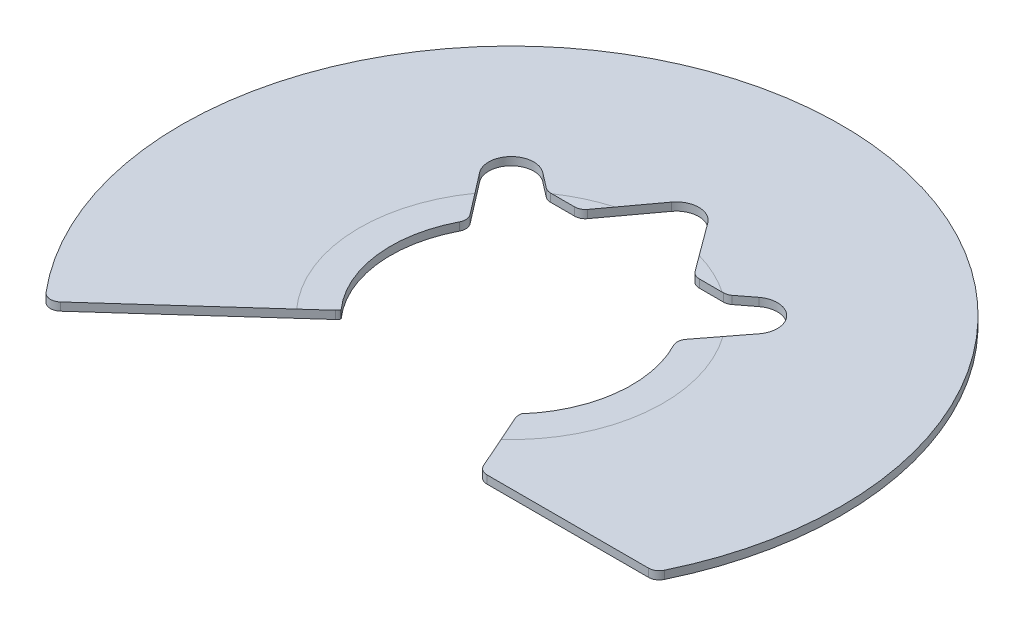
SolidWorks part; units mm, degrees
ref_plane "Front Plane" through (0, 0, 0) normal (0, 0, 1) x (1, 0, 0)
ref_plane "Top Plane" through (0, 0, 0) normal (0, 1, 0) x (1, 0, 0)
ref_plane "Right Plane" through (0, 0, 0) normal (1, 0, 0) x (0, 0, -1)
sketch "Sketch1" plane through (0, 0, 0) normal (0, 1, 0) x (1, 0, 0)
  line L0 (-72.6721, -65.4343) -> (-26.67, -24.0138)
  line L1 (-26.67, -24.0138) -> (-26.67, 12.8531)
  line L4 (0, 0) -> (0, 105.2902) construction
  line L8 (0, 0) -> (-72.6721, -65.4343) construction
  line L9 (35.2071, -44.45) -> (87.1039, -44.45)
  line L11 (-26.67, 37.2649) -> (-6.6675, 37.2649)
  line L15 (6.6675, 37.2649) -> (26.67, 37.2649)
  line L17 (6.6675, 48.895) -> (6.6675, 29.6862)
  line L18 (-6.6675, 29.6863) -> (-6.6675, 48.895)
  line L19 (6.6675, 48.895) -> (6.6675, 37.2649)
  line L20 (-6.6675, 37.2649) -> (-6.6675, 48.895)
  line L43 (-6.6675, 48.895) -> (-6.6675, 29.6863)
  line L44 (-10.3187, 26.035) -> (-10.7955, 26.035)
  line L45 (-13.0182, 26.7895) -> (-32.0265, 41.3751)
  line L46 (-41.3751, 32.0265) -> (-26.7895, 13.0182)
  line L47 (-26.035, 10.7955) -> (-26.035, -22.9553)
  line L48 (-26.3474, -24.4331) -> (-32.767, -38.937)
  line L49 (-21.6693, -46.0456) -> (-5.1121, -27.2712)
  line L50 (-2.3736, -26.035) -> (2.3736, -26.035)
  line L51 (5.1121, -27.2712) -> (21.6693, -46.0456)
  line L52 (32.767, -38.937) -> (26.3474, -24.4331)
  line L53 (26.035, -22.9553) -> (26.035, 10.7955)
  line L54 (26.7895, 13.0182) -> (41.3751, 32.0265)
  line L55 (32.0265, 41.3751) -> (13.0182, 26.7895)
  line L56 (10.7955, 26.035) -> (10.3188, 26.035)
  line L57 (6.6675, 29.6862) -> (6.6675, 48.895)
  line L60 (-26.67, 37.2649) -> (-32.0265, 41.3751)
  line L61 (-41.3751, 32.0265) -> (-26.7895, 13.0182)
  line L67 (35.2071, -44.45) -> (26.67, -25.1619)
  line L69 (26.7895, 13.0182) -> (41.3751, 32.0265)
  line L70 (32.0265, 41.3751) -> (26.67, 37.2649)
  line L642 (27.9044, 22.2464) -> (6.6675, 48.8846) construction
  line L646 (27.3086, 21.7714) -> (3.4756, 51.6659) construction
  line L943 (26.67, -25.1619) -> (26.67, 12.8531)
  arc A0 (87.1039, -44.45) -> (-72.6721, -65.4343) centre (0, 0) ccw
  arc A5 (30.6089, -34.0612) -> (26.67, -37.226) centre (0, 0) ccw construction
  circle A6 centre (0, 0) radius 45 construction
  arc A13 (6.6675, 48.895) -> (-6.6675, 48.895) centre (0, 48.895) ccw
  arc A14 (6.6675, 48.895) -> (-6.6675, 48.895) centre (0, 48.895) ccw
  arc A43 (6.6675, 48.895) -> (-6.6675, 48.895) centre (0, 48.895) ccw
  arc A44 (-10.3187, 26.035) -> (-6.6675, 29.6863) centre (-10.3187, 29.6863) ccw
  arc A45 (-13.0182, 26.7895) -> (-10.7955, 26.035) centre (-10.7955, 29.6863) ccw
  arc A46 (-32.0265, 41.3751) -> (-41.3751, 32.0265) centre (-36.0854, 36.0854) ccw
  arc A47 (-26.035, 10.7955) -> (-26.7895, 13.0182) centre (-29.6862, 10.7955) ccw
  arc A48 (-26.3474, -24.4331) -> (-26.035, -22.9553) centre (-29.6862, -22.9553) ccw
  arc A49 (-32.767, -38.937) -> (-21.6693, -46.0456) centre (-26.67, -41.6356) ccw
  arc A50 (-2.3736, -26.035) -> (-5.1121, -27.2712) centre (-2.3736, -29.6862) ccw
  arc A51 (5.1121, -27.2712) -> (2.3736, -26.035) centre (2.3736, -29.6862) ccw
  arc A52 (21.6693, -46.0456) -> (32.767, -38.937) centre (26.67, -41.6356) ccw
  arc A53 (26.035, -22.9553) -> (26.3474, -24.4331) centre (29.6863, -22.9553) ccw
  arc A54 (26.7895, 13.0182) -> (26.035, 10.7955) centre (29.6863, 10.7955) ccw
  arc A55 (41.3751, 32.0265) -> (32.0265, 41.3751) centre (36.0854, 36.0854) ccw
  arc A56 (10.7955, 26.035) -> (13.0182, 26.7895) centre (10.7955, 29.6862) ccw
  arc A57 (6.6675, 29.6862) -> (10.3188, 26.035) centre (10.3188, 29.6862) ccw
  arc A61 (-32.0265, 41.3751) -> (-41.3751, 32.0265) centre (-36.0854, 36.0854) ccw
  arc A62 (-26.67, 12.8531) -> (-26.7895, 13.0182) centre (-29.6862, 10.7955) ccw
  arc A69 (26.7895, 13.0182) -> (26.67, 12.8531) centre (29.6863, 10.7955) ccw
  arc A70 (41.3751, 32.0265) -> (32.0265, 41.3751) centre (36.0854, 36.0854) ccw
  circle A599 centre (0, 0) radius 35.687 construction
  arc A600 (26.6146, -22.6146) -> (27.3086, 21.7714) centre (0, 0) ccw construction
  point P22 (-26.67, 57.15)
  point P25 (26.67, 57.15)
  dimension "D1" = 195.58
  dimension "D7" = 1.905
  dimension "D8" = 0.7937
  dimension "D5" = 1.905
  dimension "D10" = 37.2649
  dimension "D6" = 0.762
  dimension "D2" = 26.67
  dimension "D3" = 44.45
  dimension "D4" = 132
  dimension "D9" = 26.67
  dimension "D11" = 0.762
extrude "Boss-Extrude1" add sketch "Sketch1" along normal blind 2.3813
sketch "Sketch2" plane through (0, 2.3813, 0) normal (0, 1, 0) x (1, 0, 0)
  circle A0 centre (0, 0) radius 44.9961
  dimension "D1" = 89.9922
sketch "Sketch3" plane through (0, 2.3813, 0) normal (0, 1, 0) x (1, 0, 0)
  line L0 (5.3662, 52.8522) -> (28.7219, 21.1805)
  line L1 (-5.3662, 52.8522) -> (-28.7219, 21.1805)
  arc A0 (-28.7219, 21.1805) -> (28.7219, 21.1805) centre (0, 0) ccw
  arc A2 (87.1039, -44.45) -> (-72.6721, -65.4343) centre (0, 0) ccw construction
  arc A3 (6.6675, 48.895) -> (-6.6675, 48.895) centre (0, 48.895) ccw construction
  arc A4 (-5.3662, 52.8522) -> (5.3662, 52.8522) centre (0, 48.895) cw
  dimension "D1" = 71.374
extrude "Cut-Extrude1" cut sketch "Sketch3" against normal through all
fillet "Fillet1" radius 3.175 11 edges at (87.1039, 1.1906, 44.45) (35.2071, 1.1906, 44.45) (26.67, 1.1906, 25.1619) (-26.67, 1.1906, 24.0138) (-72.6721, 1.1906, 65.4343) (-26.67, 1.1906, -37.2649) (26.67, 1.1906, -37.2649) (16.8608, 1.1906, -37.2649) (30.727, 1.1906, -18.1497) (-16.8608, 1.1906, -37.2649) (-30.727, 1.1906, -18.1497)
